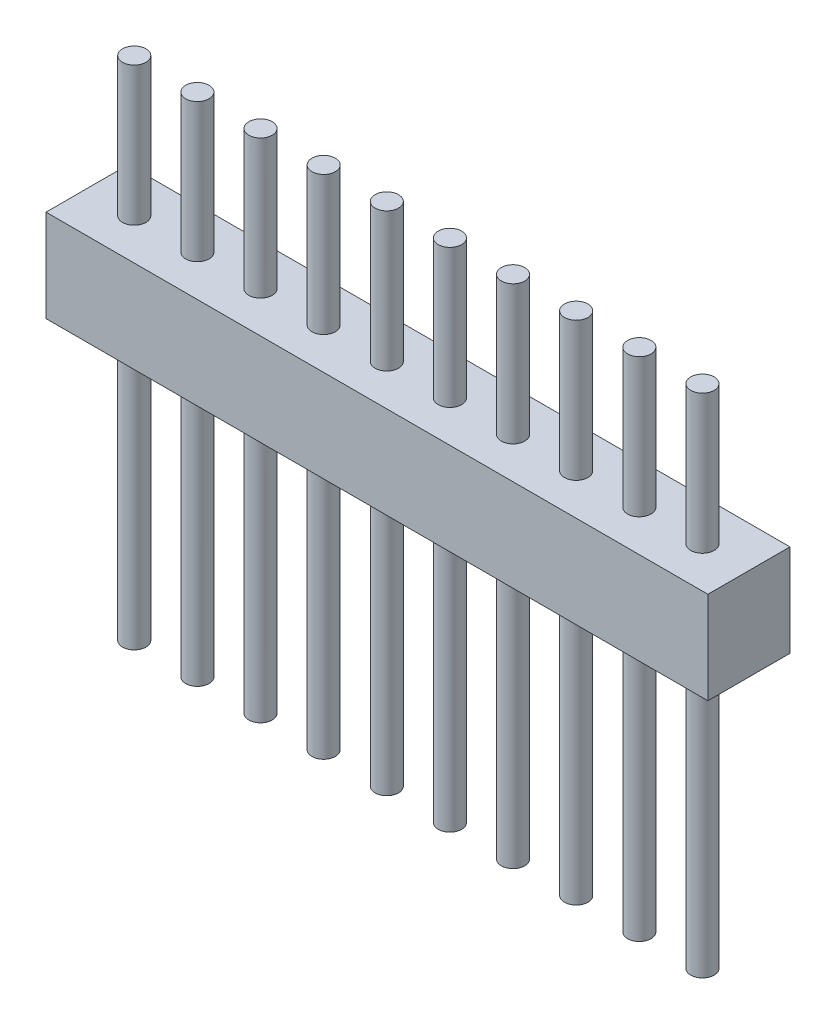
SolidWorks part; units mm, degrees
ref_plane "Front Plane" through (0, 0, 0) normal (0, 0, 1) x (1, 0, 0)
ref_plane "Top Plane" through (0, 0, 0) normal (0, 1, 0) x (1, 0, 0)
ref_plane "Right Plane" through (0, 0, 0) normal (1, 0, 0) x (0, 0, -1)
sketch "Sketch1" plane through (0, 0, 0) normal (0, 1, 0) x (1, 0, 0)
  line L1 (0, 0) -> (18.66, 0)
  line L2 (0, 0) -> (0, 2.314)
  line L3 (0, 2.314) -> (18.66, 2.314)
  line L4 (18.66, 0) -> (18.66, 2.314)
  dimension "D1" = 18.66
  dimension "D2" = 2.314
extrude "Boss-Extrude1" add sketch "Sketch1" along normal blind 2.6
sketch "Sketch2" plane through (0, 2.6, 0) normal (0, 1, 0) x (1, 0, 0)
  line L0 (0, 1.157) -> (18.66, 1.157) construction
  line L1 (0, 2.314) -> (0, 0) construction
  line L2 (18.66, 0) -> (18.66, 2.314) construction
  circle A0 centre (1.33, 1.157) radius 0.33
  circle A1 centre (3.11, 1.157) radius 0.33
  circle A2 centre (4.89, 1.157) radius 0.33
  circle A3 centre (6.67, 1.157) radius 0.33
  circle A4 centre (8.45, 1.157) radius 0.33
  circle A5 centre (10.23, 1.157) radius 0.33
  circle A6 centre (12.01, 1.157) radius 0.33
  circle A7 centre (13.79, 1.157) radius 0.33
  circle A8 centre (15.57, 1.157) radius 0.33
  circle A9 centre (17.35, 1.157) radius 0.33
  dimension "D1" = 0.66
  dimension "D2" = 1.33
  dimension "D3" = 10
extrude "Boss-Extrude2" add sketch "Sketch2" along normal blind 3.91 and the other way blind 10.37
